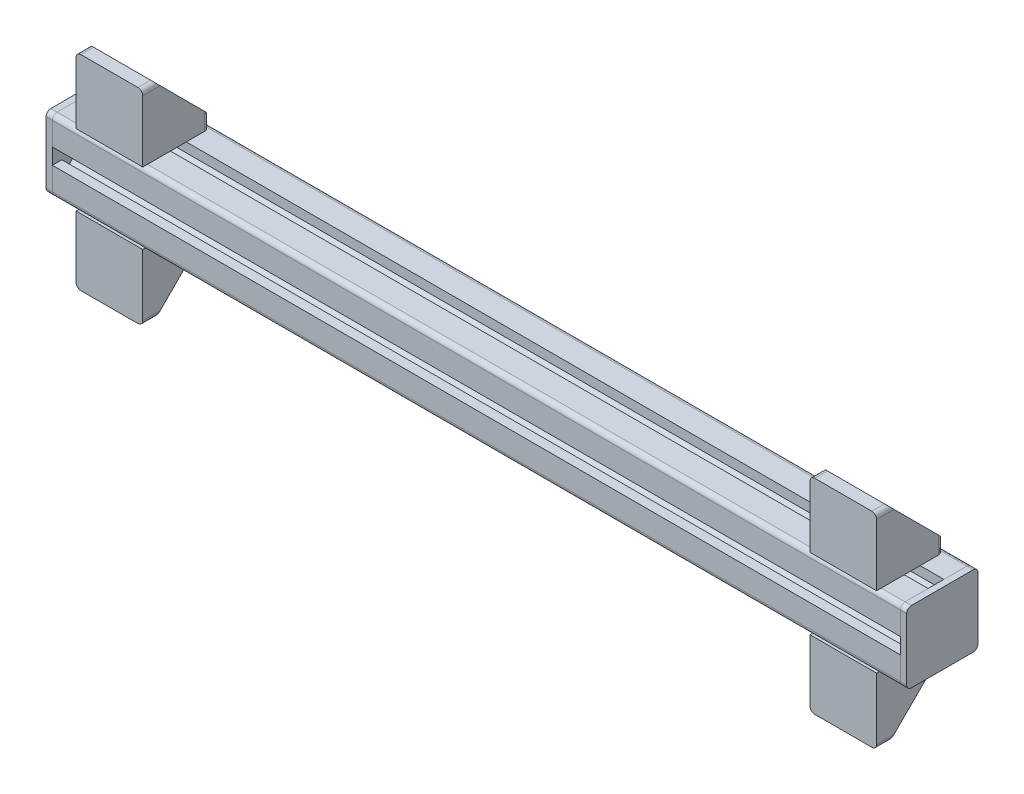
SolidWorks part; units mm, degrees
ref_plane "Front Plane" through (0, 0, 0) normal (0, 0, 1) x (1, 0, 0)
ref_plane "Top Plane" through (0, 0, 0) normal (0, 1, 0) x (1, 0, 0)
ref_plane "Right Plane" through (0, 0, 0) normal (1, 0, 0) x (0, 0, -1)
sketch "Sketch2" plane through (0, 0, 0) normal (0, 1, 0) x (1, 0, 0)
  line L0 (145.5, 0) -> (-145.5, 0) construction
  line L1 (231.5, 0) -> (-231.5, 0) construction
  line L2 (231.5, 0) -> (267.5, 0) construction
  line L3 (-231.5, 0) -> (-267.5, 0) construction
  dimension "D1" = 36
  dimension "D2" = 86
  dimension "D3" = 291
ref_plane "Plane1" through (231.5, 0, 0) normal (1, 0, 0) x (0, 0, -1)
ref_plane "Plane2" through (145.5, 0, 0) normal (1, 0, 0) x (0, 0, -1)
sketch "Sketch1" plane through (0, 0, 0) normal (1, 0, 0) x (0, 0, -1)
  line B0 (0, 0) -> (0, -40) construction
  line B1 (-19.5, 22.5) -> (-5, 22.5)
  line B2 (-22.5, 19.5) -> (-22.5, 5)
  line B3 (-19.5, -22.5) -> (-5, -22.5)
  line B4 (22.5, 19.5) -> (22.5, 5)
  line B5 (-22.5, 22.5) -> (22.5, -22.5) construction
  line B6 (-22.5, -22.5) -> (22.5, 22.5) construction
  arc B7 (-22.5, -19.5) -> (-19.5, -22.5) centre (-19.5, -19.5) ccw
  arc B8 (19.5, -22.5) -> (22.5, -19.5) centre (19.5, -19.5) ccw
  arc B9 (22.5, 19.5) -> (19.5, 22.5) centre (19.5, 19.5) ccw
  arc B10 (-19.5, 22.5) -> (-22.5, 19.5) centre (-19.5, 19.5) ccw
  line B11 (-30.3809, 0) -> (30.3809, 0) construction
  line B12 (-5, 22.5) -> (-5, 16.5)
  line B13 (-5, 16.5) -> (-10, 16.5)
  line B14 (-10, 16.5) -> (-10, 12)
  line B15 (-10, 12) -> (-7.5, 9.5)
  line B16 (-7.5, 9.5) -> (7.5, 9.5)
  line B17 (7.5, 9.5) -> (10, 12)
  line B18 (10, 12) -> (10, 16.5)
  line B19 (10, 16.5) -> (5, 16.5)
  line B20 (5, 16.5) -> (5, 22.5)
  line B21 (5, 22.5) -> (19.5, 22.5)
  line B22 (5, -16.5) -> (5, -22.5)
  line B23 (10, -16.5) -> (5, -16.5)
  line B24 (10, -12) -> (10, -16.5)
  line B25 (7.5, -9.5) -> (10, -12)
  line B26 (-7.5, -9.5) -> (7.5, -9.5)
  line B27 (-10, -12) -> (-7.5, -9.5)
  line B28 (-10, -16.5) -> (-10, -12)
  line B29 (-5, -16.5) -> (-10, -16.5)
  line B30 (-5, -22.5) -> (-5, -16.5)
  line B31 (5, -22.5) -> (19.5, -22.5)
  line B32 (-22.5, 5) -> (-16.5, 5)
  line B33 (-16.5, 5) -> (-16.5, 10)
  line B34 (-16.5, 10) -> (-12, 10)
  line B35 (-12, 10) -> (-9.5, 7.5)
  line B36 (-9.5, 7.5) -> (-9.5, -7.5)
  line B37 (-9.5, -7.5) -> (-12, -10)
  line B38 (-12, -10) -> (-16.5, -10)
  line B39 (-16.5, -10) -> (-16.5, -5)
  line B40 (-16.5, -5) -> (-22.5, -5)
  line B41 (16.5, -5) -> (22.5, -5)
  line B42 (16.5, -10) -> (16.5, -5)
  line B43 (12, -10) -> (16.5, -10)
  line B44 (9.5, -7.5) -> (12, -10)
  line B45 (9.5, 7.5) -> (9.5, -7.5)
  line B46 (12, 10) -> (9.5, 7.5)
  line B47 (16.5, 10) -> (12, 10)
  line B48 (16.5, 5) -> (16.5, 10)
  line B49 (22.5, 5) -> (16.5, 5)
  line B50 (-22.5, -5) -> (-22.5, -19.5)
  line B51 (22.5, -5) -> (22.5, -19.5)
sketch_block_instance "45 X 45 PROFILE-1"
sketch_block "45 X 45 PROFILE" parameters "D1"=3, "D2"=40, "D3"=60.373, "D4"=3.8293, "D5"=3, "D6"=3, "D7"=6.5083, "D8"=3.7565, "D9"=9.5, "D10"=14.5, "D11"=2.5183
extrude "Boss-Extrude1" add sketch "Sketch1" along normal up to vertex (267.5 mm away) and the other way up to vertex (267.5 mm away)
sketch "Sketch3" plane through (231.5, 0, 0) normal (1, 0, 0) x (0, 0, -1)
  line L0 (-22.5, -5) -> (-22.5, -19.5) construction
  line L1 (-19.5, -22.5) -> (-5, -22.5) construction
  line L2 (-5, 22.5) -> (-19.5, 22.5) construction
  line L3 (-22.5, 19.5) -> (-22.5, 5) construction
  line B0 (19.5, 22.5) -> (-22.5, 22.5)
  line B1 (-22.5, 22.5) -> (-22.5, 64.5)
  line B2 (-14.5, 64.5) -> (-22.5, 64.5)
  line B3 (-14.5, 64.5) -> (19.5, 30.5)
  line B4 (19.5, 30.5) -> (19.5, 22.5)
  line B5 (-22.5, -64.5) -> (-22.5, -22.5)
  line B6 (-22.5, -22.5) -> (19.5, -22.5)
  line B7 (19.5, -30.5) -> (19.5, -22.5)
  line B8 (19.5, -30.5) -> (-14.5, -64.5)
  line B9 (-14.5, -64.5) -> (-22.5, -64.5)
sketch_block_instance "Gusset-1"
sketch_block "Gusset" parameters "D1"=8, "D2"=42
sketch_block_instance "Gusset-2"
extrude "Boss-Extrude2" add sketch "Sketch3" along normal mid plane 42 separate body
sketch "Sketch4" plane through (145.5, 0, 0) normal (1, 0, 0) x (0, 0, -1)
  line L0 (19.5, 22.5) -> (5, 22.5) construction
  line L1 (22.5, 5) -> (22.5, 19.5) construction
  line B0 (22.5, -19.5) -> (22.5, 22.5)
  line B1 (22.5, 22.5) -> (64.5, 22.5)
  line B2 (64.5, 14.5) -> (64.5, 22.5)
  line B3 (64.5, 14.5) -> (30.5, -19.5)
  line B4 (30.5, -19.5) -> (22.5, -19.5)
sketch_block_instance "Gusset-4"
extrude "Boss-Extrude3" [suppressed] add sketch "Sketch4" along normal mid plane 42 separate body
fillet "Fillet1" radius 3 4 edges at (210.5, 26.5, -19.5) (252.5, 26.5, -19.5) (210.5, 64.5, 18.5) (252.5, 64.5, 18.5)
fillet "Fillet2" radius 3 4 edges at (210.5, -64.5, 18.5) (252.5, -64.5, 18.5) (210.5, -26.5, -19.5) (252.5, -26.5, -19.5)
fillet "Fillet3" [suppressed] radius 3
sketch "Sketch5" plane through (267.5, 0, 0) normal (1, 0, 0) x (0, 0, -1)
  line L0 (-5, 22.5) -> (-19.5, 22.5) construction
  line L1 (-22.5, -5) -> (-22.5, -19.5) construction
  line L2 (5, -22.5) -> (19.5, -22.5) construction
  line L3 (22.5, 5) -> (22.5, 19.5) construction
  line L4 (19.5, 22.5) -> (-19.5, 22.5)
  line L5 (-22.5, 19.5) -> (-22.5, -19.5)
  line L6 (-19.5, -22.5) -> (19.5, -22.5)
  line L7 (22.5, -19.5) -> (22.5, 19.5)
  arc A0 (-19.5, 22.5) -> (-22.5, 19.5) centre (-19.5, 19.5) ccw construction
  arc A1 (-22.5, -19.5) -> (-19.5, -22.5) centre (-19.5, -19.5) ccw construction
  arc A2 (19.5, -22.5) -> (22.5, -19.5) centre (19.5, -19.5) ccw construction
  arc A3 (22.5, 19.5) -> (19.5, 22.5) centre (19.5, 19.5) ccw construction
  arc A4 (-19.5, 22.5) -> (-22.5, 19.5) centre (-19.5, 19.5) ccw
  arc A5 (-22.5, -19.5) -> (-19.5, -22.5) centre (-19.5, -19.5) ccw
  arc A6 (19.5, -22.5) -> (22.5, -19.5) centre (19.5, -19.5) ccw
  arc A7 (22.5, 19.5) -> (19.5, 22.5) centre (19.5, 19.5) ccw
extrude "Boss-Extrude4" add sketch "Sketch5" along normal blind 4 separate body
mirror "Mirror1" about plane through (0, 0, 0) normal (1, 0, 0)
pattern_curve "CrvPattern1" [suppressed] parameters "D1"=2, "D3"=10, "D2"=1, "D4"=10
ref_plane "Plane3" through (191, 0, 0) normal (1, 0, 0) x (0, 0, -1)
ref_plane "Plane4" through (0, 0, 21.5) normal (0, 0, -1) x (-1, 0, 0)
ref_plane "Plane5" through (0, 103, 0) normal (0, 1, 0) x (1, 0, 0)
